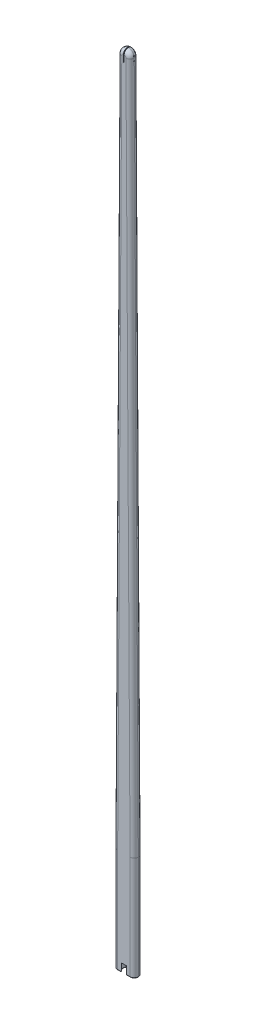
SolidWorks part; units mm, degrees
ref_plane "Спереди" through (0, 0, 0) normal (0, 0, 1) x (1, 0, 0)
ref_plane "Сверху" through (0, 0, 0) normal (0, 1, 0) x (1, 0, 0)
ref_plane "Справа" through (0, 0, 0) normal (1, 0, 0) x (0, 0, -1)
sketch "Эскиз1" plane through (0, 0, 0) normal (0, 0, 1) x (1, 0, 0)
  line L0 (-15, 0) -> (15, 0)
  line L1 (-15, 0) -> (-15, 151)
  line L2 (15, 0) -> (15, 151)
  line L3 (0, 0) -> (0, 1151) construction
  line L4 (-15, 151) -> (-8.9998, 1151.054)
  line L5 (15, 151) -> (8.9998, 1151.054)
  arc A0 (8.9998, 1151.054) -> (-8.9998, 1151.054) centre (0, 1151) ccw
  dimension "D2" = 18
  dimension "D1" = 30
  dimension "D3" = 1151
  dimension "D4" = 1000
extrude "Бобышка-Вытянуть1" add sketch "Эскиз1" along normal mid plane 12
fillet "Скругление1" radius 6 10 edges at (-15, 75.5, -6) (-15, 75.5, 6) (15, 75.5, -6) (15, 75.5, 6) (0, 1160, -6) (0, 1160, 6) (-11.9999, 651.027, -6) (-11.9999, 651.027, 6) (11.9999, 651.027, -6) (11.9999, 651.027, 6)
sketch "Эскиз2" plane through (0, 0, 0) normal (0, 0, 1) x (1, 0, 0)
  line L0 (0, 0) -> (0, 50)
  line L1 (0, 0) -> (-7, 0)
  line L2 (-9, 0) -> (9, 0) construction
  line L3 (-7, 0) -> (-7, 12)
  line L4 (-7, 12) -> (-5, 12)
  line L5 (-5, 12) -> (-5, 46.9957)
  line L6 (-5, 46.9957) -> (0, 50)
  dimension "D1" = 7
  dimension "D2" = 12
  dimension "D3" = 5
  dimension "D4" = 59
  dimension "D5" = 50
revolve "Вырез-Повернуть2" cut sketch "Эскиз2" angle 360 about L0
fillet "Скругление2" radius 1 10 edges at (6.3028, 0, 6) (13.2426, 0, 4.2426) (13.2426, 0, -4.2426) (6.3028, 0, -6) (-7, 0, 0) (7, 0, 0) (-6.3028, 0, -6) (-13.2426, 0, -4.2426) (-13.2426, 0, 4.2426) (-6.3028, 0, 6)
sketch "Эскиз3" plane through (0, 0, 0) normal (0, 0, 1) x (1, 0, 0)
  line L1 (0.5, 1160) -> (-0.5, 1160)
  line L2 (0.5, 1160) -> (0.5, 1143.746)
  line L3 (0.5, 1143.746) -> (-0.5, 1143.746)
  line L4 (-0.5, 1160) -> (-0.5, 1143.746)
  line L5 (0.5, 1160) -> (-0.5, 1143.746) construction
  line L6 (0.5, 1143.746) -> (-0.5, 1160) construction
  arc A0 (2.9999, 1151.018) -> (-2.9999, 1151.018) centre (0, 1151) ccw construction
  arc A1 (2.9999, 1151.018) -> (-2.9999, 1151.018) centre (0, 1151) ccw construction
  arc A2 (8.9998, 1151.054) -> (-8.9998, 1151.054) centre (0, 1151) ccw construction
  point P0 (0, 1151.873)
  dimension "D1" = 7.254
  dimension "D2" = 1
extrude "Вырез-Вытянуть1" cut sketch "Эскиз3" against normal mid plane 20
sketch "Эскиз4" plane through (0, 0, 0) normal (1, 0, 0) x (0, 0, -1)
  line L0 (0, 151) -> (0, 1151.054) construction
  circle A0 centre (0, 1153.246) radius 0.5
  circle A1 centre (0, 1147.246) radius 0.5
  point P6 (0, 1151)
  dimension "D1" = 1
  dimension "D2" = 6
  dimension "D3" = 2.246
extrude "Вырез-Вытянуть2" cut sketch "Эскиз4" against normal mid plane 20
fillet "Скругление3" radius 0.25 12 edges at (-8.7055, 1153.2004, -0.4979) (-8.6823, 1153.2902, 0.498) (8.6823, 1153.2902, -0.498) (8.7055, 1153.2004, 0.4979) (-0.5, 1152.746, 0) (0.5, 1153.746, 0) (9.0017, 1147.3002, 0.4971) (9.0018, 1147.2486, -0.5) (-9.0024, 1147.1918, 0.4971) (-9.0018, 1147.2434, -0.5) (-0.5, 1146.746, 0) (0.5, 1147.746, 0)
